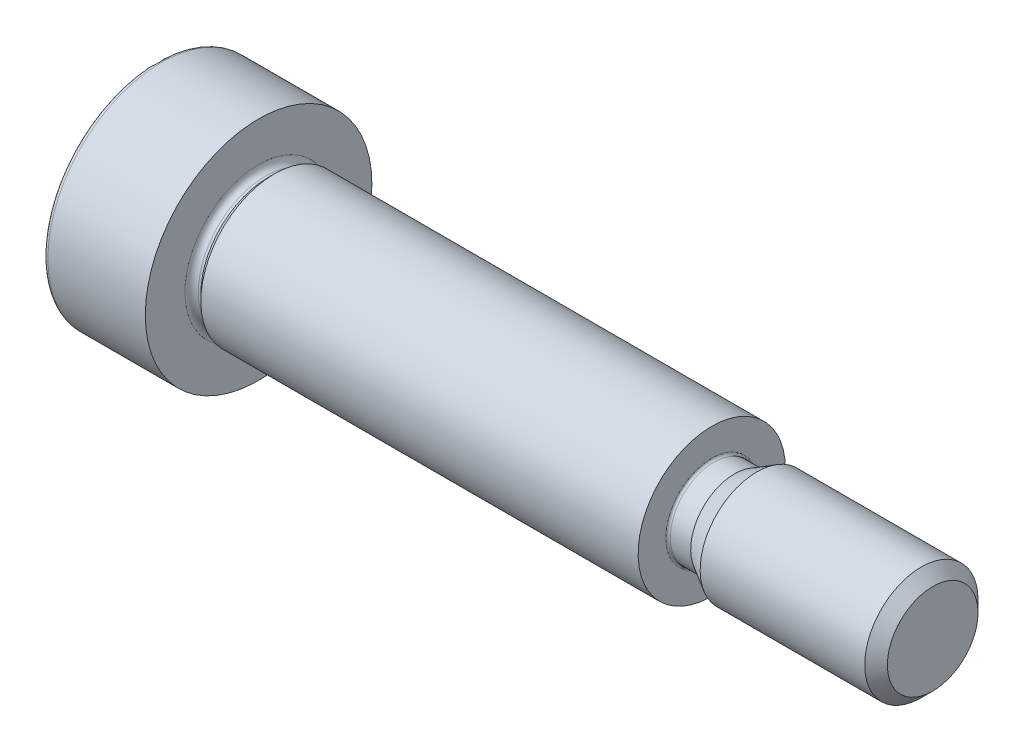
SolidWorks part; units mm, degrees
ref_plane "Front" through (0, 0, 0) normal (0, 0, 1) x (1, 0, 0)
ref_plane "Top" through (0, 0, 0) normal (0, 1, 0) x (1, 0, 0)
ref_plane "Right" through (0, 0, 0) normal (1, 0, 0) x (0, 0, -1)
other "Configuration Table"
sketch "Sketch1" plane through (0, 0, 0) normal (1, 0, 0) x (0, 0, -1)
  circle A0 centre (0, 0) radius 5
extrude "BaseHead" add sketch "Sketch1" along normal blind 4.5
sketch "Sketch2" plane through (4.5, 0, 0) normal (1, 0, 0) x (0, 0, -1)
  circle A0 centre (0, 0) radius 3.25
  dimension "ds" = 6.5
extrude "BaseBody" add sketch "Sketch2" along normal blind 20
sketch "Sketch3" plane through (24.5, 0, 0) normal (1, 0, 0) x (0, 0, -1)
  circle A0 centre (0, 0) radius 2.5
extrude "BaseEnd" add sketch "Sketch3" along normal blind 9.75
sketch "Sketch4" plane through (-14.7581, 7.8281, 0) normal (0, 0, 1) x (0, -1, 0)
  line L0 (7.8281, 27.7861) -> (7.8281, 17.3801) construction
  line L1 (0.8981, 40.2581) -> (3.8981, 40.2581)
  line L2 (0.8981, 40.2581) -> (0.8981, 39.2581)
  line L3 (0.8981, 39.2581) -> (5.8981, 39.2581)
  line L4 (5.8981, 40.2581) -> (5.8981, 39.2581)
  line L7 (5.8981, 40.2581) -> (3.8981, 43.7222)
  line L8 (3.8981, 43.7222) -> (3.8981, 40.2581)
  line L9 (11.0781, 39.2581) -> (4.5781, 39.2581) construction
revolve "Cut-Revolve2" cut sketch "Sketch4" angle 360 about L0
fillet "Fillet1" radius 0.1 1 edges at (24.5, 1.93, 0)
sketch "Sketch5" plane through (0, 0, 0) normal (1, 0, 0) x (0, 0, -1)
  line L1 (1.7321, 0) -> (0.866, 1.5)
  line L2 (0.866, 1.5) -> (-0.866, 1.5)
  line L3 (-0.866, 1.5) -> (-1.7321, 0)
  line L4 (-1.7321, 0) -> (-0.866, -1.5)
  line L5 (-0.866, -1.5) -> (0.866, -1.5)
  line L6 (0.866, -1.5) -> (1.7321, 0)
  circle A0 centre (0, 0) radius 1.5 construction
  dimension "s" = 3
extrude "Socket" cut sketch "Sketch5" along normal blind 2.4
sketch "Sketch6" plane through (2.4, 0, 0) normal (-1, 0, 0) x (0, 0, 1)
  line L0 (1.7321, 0) -> (0.866, -1.5) construction
  line L1 (0.866, -1.5) -> (-0.866, -1.5) construction
  line L2 (-0.866, -1.5) -> (-1.7321, 0) construction
  line L3 (0.866, 1.5) -> (1.7321, 0) construction
  line L4 (-1.7321, 0) -> (-0.866, 1.5) construction
  line L5 (-0.866, 1.5) -> (0.866, 1.5) construction
  line L6 (1.7321, 0) -> (0.866, -1.5)
  line L7 (0.866, -1.5) -> (-0.866, -1.5)
  line L8 (-0.866, -1.5) -> (-1.7321, 0)
  line L9 (0.866, 1.5) -> (1.7321, 0)
  line L10 (-1.7321, 0) -> (-0.866, 1.5)
  line L11 (-0.866, 1.5) -> (0.866, 1.5)
extrude "Cut-Extrude2" cut sketch "Sketch6" against normal blind 10 draft 60
sketch "Sketch7" plane through (-6.2703, -1.6897, 0) normal (0, 0, 1) x (0, -1, 0)
  line L1 (-9.6497, 10.7703) -> (-4.9497, 10.7703)
  line L2 (-9.6497, 10.7703) -> (-9.6497, 11.1805)
  line L3 (-9.6497, 11.1805) -> (-7.6497, 11.1805)
  line L4 (-4.6497, 11.0703) -> (-4.6497, 11.1805)
  line L5 (-1.6897, 18.8023) -> (-1.6897, 7.3187) construction
  line L7 (-4.6497, 11.1805) -> (-6.6497, 13.1805)
  line L8 (-6.6497, 13.1805) -> (-7.6497, 13.1805)
  line L9 (-7.6497, 13.1805) -> (-7.6497, 11.1805)
  line L10 (3.3103, 10.7703) -> (-6.6897, 10.7703) construction
  arc A0 (-4.9497, 10.7703) -> (-4.6497, 11.0703) centre (-4.9497, 11.0703) ccw
  dimension "r1" = 0.3
  dimension "D1" = 45
  dimension "dg1" = 5.92
  dimension "D2" = 5
  dimension "g1" = 0.4102
  dimension "D3" = 2
  dimension "D4" = 1
revolve "Neck" cut sketch "Sketch7" angle 360 about L5
chamfer "Chamfer1" distance 0.5 angle 45 1 edges at (34.25, 0, -2.5)
fillet "HeadFillet" radius 0.2 1 edges at (0, 0, -5)
sketch "Sketch8" plane through (0, 0, 0) normal (0, 0, 1) x (1, 0, 0)
  line L0 (33.75, 2.2835) -> (33.875, 2.5)
  line L1 (33.875, 2.5) -> (33.875, 2.75)
  line L2 (33.875, 2.75) -> (33.625, 2.75)
  line L3 (33.625, 2.75) -> (33.625, 2.5)
  line L4 (33.625, 2.5) -> (33.75, 2.2835)
  line L5 (33.75, -2.5) -> (33.75, 2.5) construction
  line L6 (0, 0) -> (37.4968, 0) construction
revolve "Cut-Revolve10" [suppressed] cut sketch "Sketch8" angle 360 about L6
pattern_linear "LPattern10" [suppressed] count 29 spacing 0.3 along (1, 0, 0)
equation "\"D1@Sketch8\" = \"d@Sketch3\""
equation "\"D2@Sketch8\" =  ( \"d@Sketch3\" - \"THD_MINOR@ThreadCosmetic1\" )  / 2"
equation "\"D3@LPattern10\" = \"D2@Sketch8\" * 1.2"
equation "\"D1@LPattern10\" =  ( \"b@BaseEnd\" - \"g2@Sketch4\" )  / \"D3@LPattern10\""
